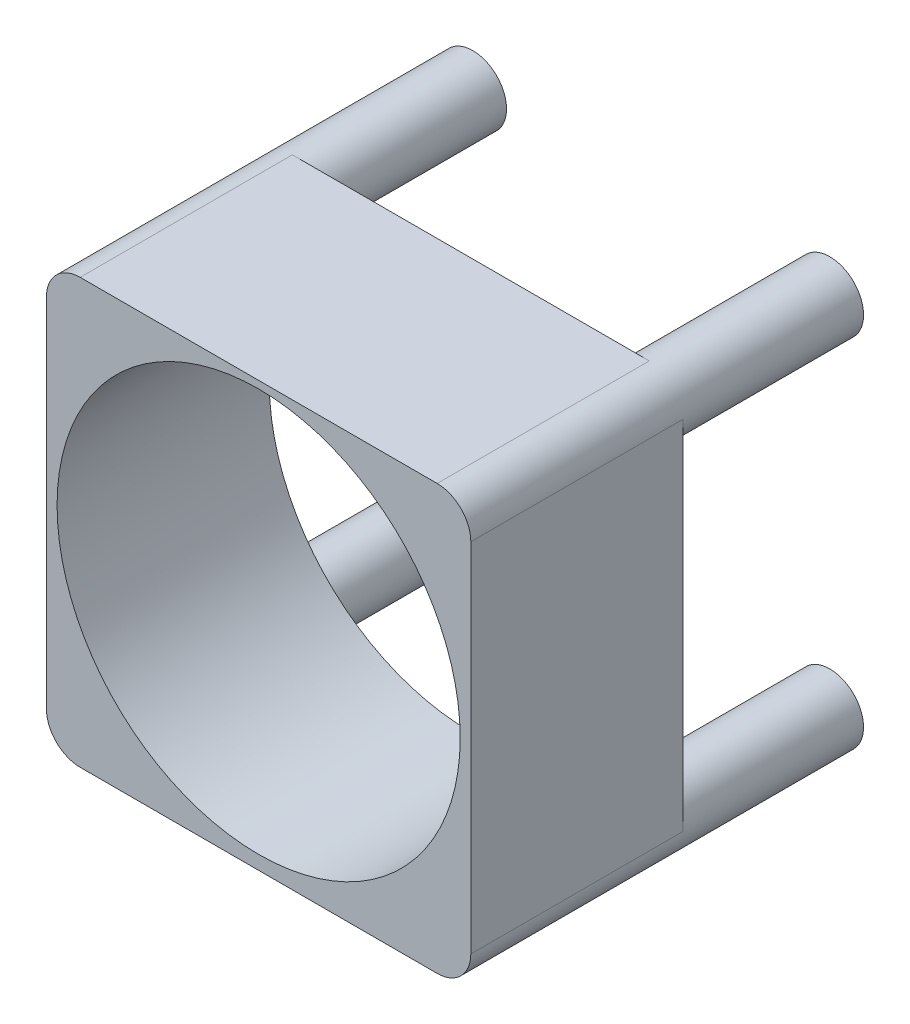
SolidWorks part; units mm, degrees
ref_plane "Front" through (0, 0, 0) normal (0, 0, 1) x (1, 0, 0)
ref_plane "Top" through (0, 0, 0) normal (0, 1, 0) x (1, 0, 0)
ref_plane "Right" through (0, 0, 0) normal (1, 0, 0) x (0, 0, -1)
sketch "Sketch1" plane through (0, 0, 0) normal (0, 0, 1) x (1, 0, 0)
  line L1 (3.175, 0) -> (36.825, 0)
  line L2 (0, 3.175) -> (0, 36.825)
  line L3 (3.175, 40) -> (36.825, 40)
  line L4 (40, 3.175) -> (40, 36.825)
  arc A0 (0, 3.175) -> (3.175, 0) centre (3.175, 3.175) ccw
  arc A1 (3.175, 40) -> (0, 36.825) centre (3.175, 36.825) ccw
  arc A2 (40, 36.825) -> (36.825, 40) centre (36.825, 36.825) ccw
  arc A3 (36.825, 0) -> (40, 3.175) centre (36.825, 3.175) ccw
  point P6 (0, 0)
  point P9 (0, 40)
  point P12 (40, 40)
  point P15 (40, 0)
  dimension "D3" = 3.175
  dimension "D1" = 40
  dimension "D2" = 40
extrude "Base-Extrude" add sketch "Sketch1" along normal blind 20
sketch "Sketch2" plane through (0, 0, 20) normal (0, 0, 1) x (1, 0, 0)
  line L0 (20, 41.7034) -> (20, -1.0981) construction
  line L1 (44.6001, 20) -> (-5.0324, 20) construction
  line L2 (36.825, 40) -> (3.175, 40) construction
  line L3 (3.175, 0) -> (36.825, 0) construction
  line L4 (40, 3.175) -> (40, 36.825) construction
  line L5 (0, 36.825) -> (0, 3.175) construction
  circle A0 centre (20, 20.3026) radius 19
  dimension "D1" = 38
extrude "Cut-Extrude1" cut sketch "Sketch2" against normal through all
sketch "Sketch3" plane through (0, 0, 0) normal (0, 0, -1) x (-1, 0, 0)
  line L3 (7.1077, 20) -> (-46.5888, 20) construction
  line L4 (-20, -2.1358) -> (-20, 41.7034) construction
  line L6 (0, 36.825) -> (0, 3.175) construction
  line L7 (-40, 3.175) -> (-40, 36.825) construction
  line L13 (-36.825, 40) -> (-3.175, 40) construction
  line L14 (-3.175, 0) -> (-36.825, 0) construction
  circle A0 centre (-3.175, 36.825) radius 3.175
  circle A1 centre (-36.825, 36.825) radius 3.175
  circle A2 centre (-3.175, 3.175) radius 3.175
  circle A3 centre (-36.825, 3.175) radius 3.175
  dimension "D1" = 6.35
extrude "Boss-Extrude1" add sketch "Sketch3" along normal blind 17.018
